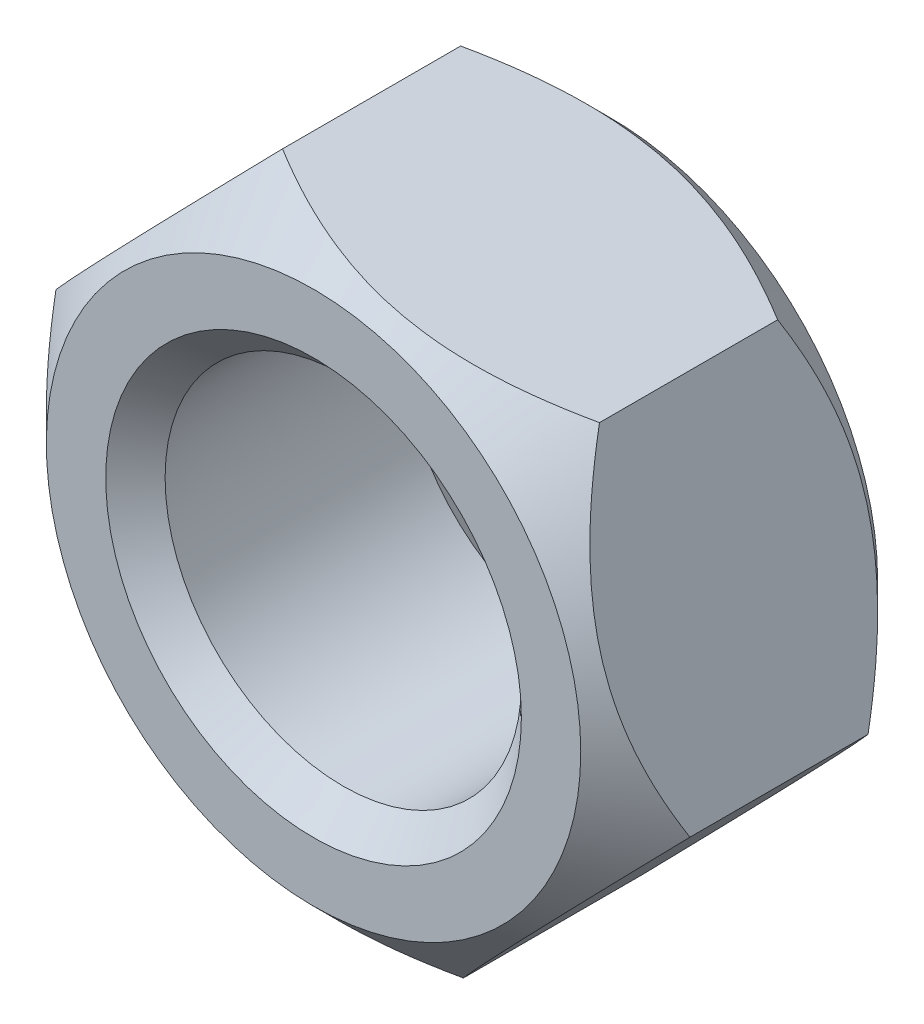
SolidWorks part; units mm, degrees
ref_plane "Plan de face" through (0, 0, 0) normal (0, 0, 1) x (1, 0, 0)
ref_plane "Plan de dessus" through (0, 0, 0) normal (0, 1, 0) x (1, 0, 0)
ref_plane "Plan de droite" through (0, 0, 0) normal (1, 0, 0) x (0, 0, -1)
sketch "Esquisse1" plane through (0, 0, 0) normal (0, 0, 1) x (1, 0, 0)
  circle A0 centre (0, 0) radius 5.5
  circle A1 centre (0, 0) radius 3
  dimension "D1" = 11
  dimension "D2" = 6
extrude "Boss.-Extru.1" add sketch "Esquisse1" along normal blind 5
chamfer "Chanfrein1" distance 1 angle 45 2 edges at (5.5, 0, 0) (5.5, 0, 5)
chamfer "Chanfrein2" distance 0.5 angle 45 2 edges at (3, 0, 5) (3, 0, 0)
sketch "Esquisse2" plane through (0, 0, 5) normal (0, 0, 1) x (1, 0, 0)
  line L0 (-3.8154, -3.9614) -> (-5.3384, 1.3236)
  arc A0 (-5.3384, 1.3236) -> (-3.8154, -3.9614) centre (0, 0) ccw
  point P12 (0, 0)
extrude "Enlèv. mat.-Extru.1" cut sketch "Esquisse2" against normal through all
pattern_circular "Répétition circulaire1" count 6 every 60 about axis through (0, 0, 0) along (0, 0, 1) of "Enlèv. mat.-Extru.1"
